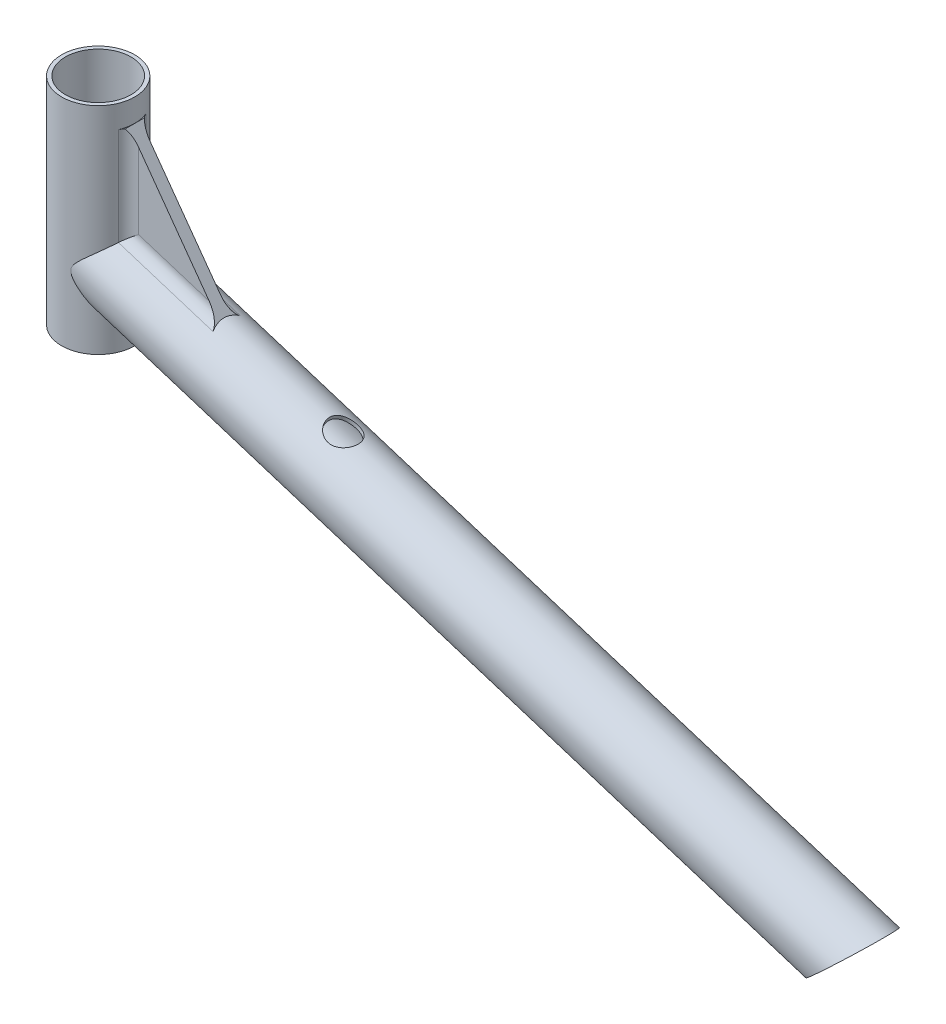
SolidWorks part; units mm, degrees
ref_plane "Plan de face" through (0, 0, 0) normal (0, 0, 1) x (1, 0, 0)
ref_plane "Plan de dessus" through (0, 0, 0) normal (0, 1, 0) x (1, 0, 0)
ref_plane "Plan de droite" through (0, 0, 0) normal (1, 0, 0) x (0, 0, -1)
sketch "Esquisse1" plane through (0, 0, 0) normal (0, 1, 0) x (1, 0, 0)
  circle A0 centre (0, 0) radius 17.5
  circle A1 centre (0, 0) radius 19.5
  dimension "D1" = 35
  dimension "D2" = 39
extrude "Boss.-Extru.1" add sketch "Esquisse1" along normal blind 115
sketch "Esquisse2" plane through (0, 0, 0) normal (0, 0, 1) x (1, 0, 0)
  line L0 (0, 38) -> (559.297, -138.3457) construction
  line L1 (0, 38) -> (467.3213, -109.3458)
  line L2 (0, 38) -> (5.7134, 56.1206)
  line L3 (467.3213, -109.3458) -> (473.0347, -91.2252)
  line L4 (5.7134, 56.1206) -> (473.0347, -91.2252)
  line L5 (19.5, 0) -> (19.5, 115) construction
  point P7 (0, 0)
  dimension "D1" = 38
  dimension "D2" = 72.5
  dimension "D3" = 38
  dimension "D4" = 490
revolve "Révolution1" add sketch "Esquisse2" angle 360 about L0
sketch "Esquisse3" plane through (0, 0, 0) normal (0, -1, 0) x (1, 0, 0)
  circle A0 centre (0, 0) radius 17.5 construction
  circle A1 centre (0, 0) radius 17.5
extrude "Enlèv. mat.-Extru.1" cut sketch "Esquisse3" against normal blind 105
ref_plane "Plan1" through (10.898, 34.5639, 0) normal (-0.3007, -0.9537, 0) x (0.9537, -0.3007, 0)
sketch "Esquisse4" plane through (0, 0, 0) normal (0, 0, 1) x (1, 0, 0)
  line L0 (499.9581, 0.4058) -> (349.1284, -137.8042)
  line L2 (349.1284, -137.8042) -> (462.3692, -261.3849)
  line L3 (462.3692, -261.3849) -> (625.3239, -112.0644)
  line L4 (625.3239, -112.0644) -> (499.9581, 0.4058)
  line L6 (19.5, 11.9296) -> (461.6079, -127.4665) construction
  line L7 (473.0347, -91.2252) -> (19.5, 51.7737) construction
  point P10 (386.3168, -103.7273)
  dimension "D1" = 60
  dimension "D2" = 400
extrude "Enlèv. mat.-Extru.2" cut sketch "Esquisse4" against normal through all both and the other way through all
ref_plane "Plan2" through (0, 38, 0) normal (0.9537, -0.3007, 0) x (0, 0, -1)
sketch "Esquisse6" plane through (0, 38, 0) normal (0.9537, -0.3007, 0) x (0, 0, -1)
  circle A0 centre (0, 0) radius 17
  circle A1 centre (0, 0) radius 19 construction
  dimension "D1" = 2
extrude "Enlèv. mat.-Extru.4" cut sketch "Esquisse6" along normal through all
sketch "Esquisse5" plane through (10.898, 34.5639, 0) normal (-0.3007, -0.9537, 0) x (0.9537, -0.3007, 0)
  line L0 (0, 0) -> (120, 0) construction
  circle A0 centre (120, 0) radius 8
  point P3 (0, 0)
  dimension "D1" = 16
  dimension "D2" = 120
extrude "Enlèv. mat.-Extru.3" cut sketch "Esquisse5" against normal blind 53
sketch "Esquisse7" plane through (0, 0, 0) normal (0, 0, 1) x (1, 0, 0)
  line L0 (19.5, 102.7849) -> (68.2038, 35.2374)
  line L1 (19.5, 51.7737) -> (19.5, 115) construction
  line L3 (68.2038, 35.2374) -> (18.2038, 50.7849)
  line L4 (18.2038, 50.7849) -> (17.3779, 102.7849)
  line L5 (17.3779, 102.7849) -> (19.5, 102.7849)
  spline S0 degree 2 poles (19.5, 11.9296) (0.9872, 37.6887) (19.5, 51.7737) knots 0 0 0 1 1 1 weights 0.0005 0.0195 0.0385 construction
  point P4 (67.9934, 35.0882)
  dimension "D1" = 52
  dimension "D2" = 50
extrude "Boss.-Extru.2" add sketch "Esquisse7" along normal mid plane 6
fillet "Congé1" radius 7 4 edges at (43.3018, 44.0191, -3) (19.2678, 77.1909, -3) (19.2678, 77.1909, 3) (43.3018, 44.0191, 3)
